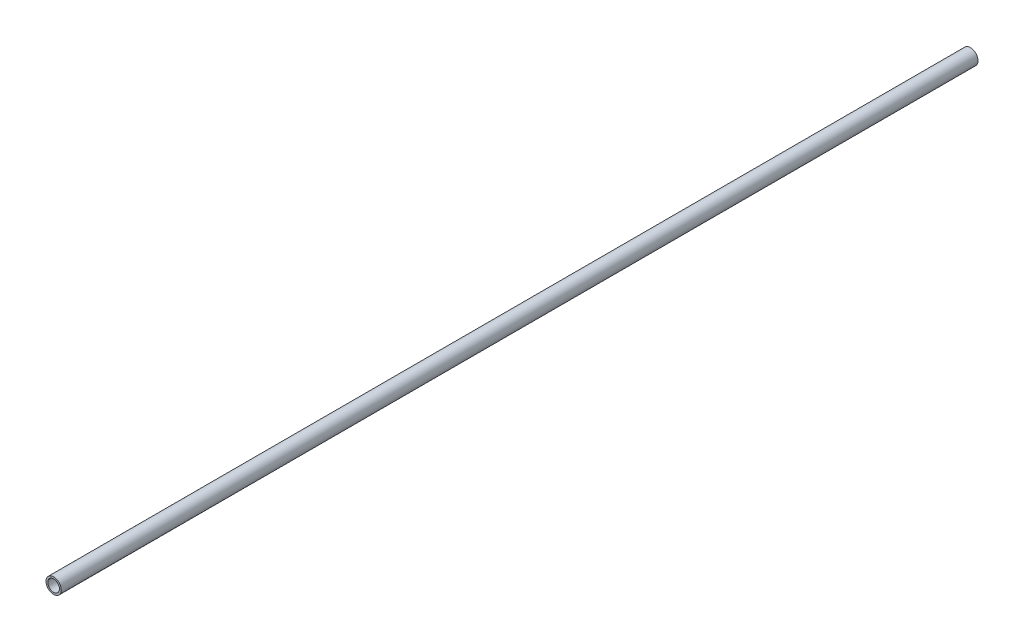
SolidWorks part; units mm, degrees
ref_plane "Front Plane" through (0, 0, 0) normal (0, 0, 1) x (1, 0, 0)
ref_plane "Top Plane" through (0, 0, 0) normal (0, 1, 0) x (1, 0, 0)
ref_plane "Right Plane" through (0, 0, 0) normal (1, 0, 0) x (0, 0, -1)
sketch "Sketch1" plane through (0, 0, 0) normal (0, 0, 1) x (1, 0, 0)
  circle A0 centre (0, 0) radius 12.5
  circle A1 centre (0, 0) radius 9.5
extrude "Boss-Extrude1" add sketch "Sketch1" along normal blind 1500
